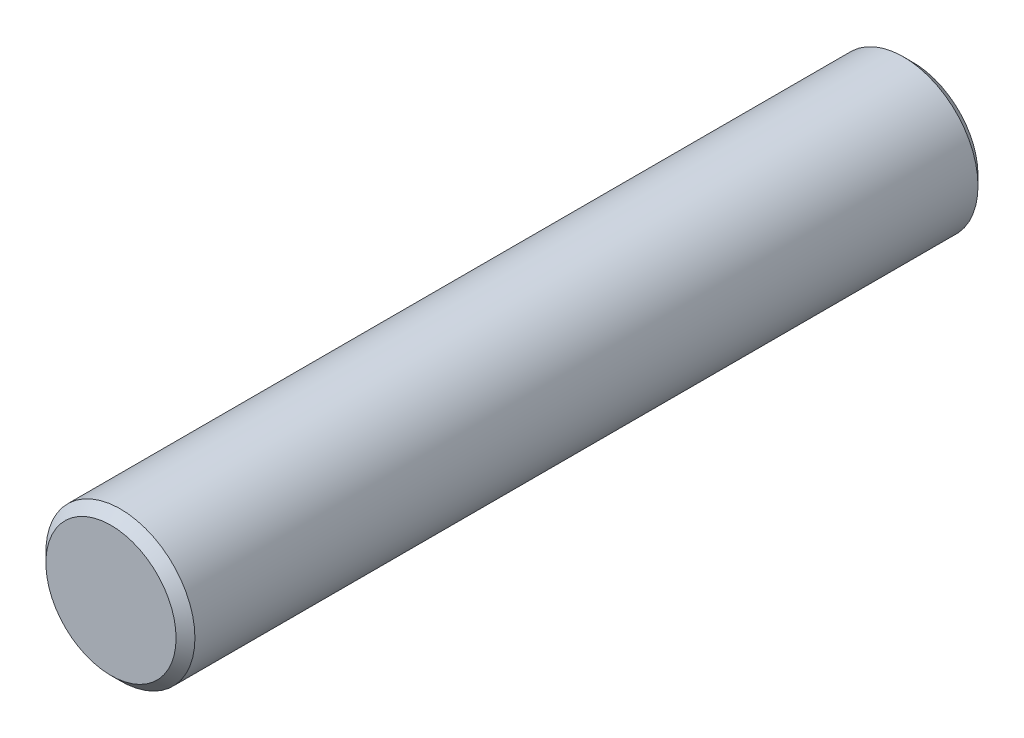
SolidWorks part; units mm, degrees
ref_plane "Plane1" through (0, 0, 0) normal (0, 0, 1) x (1, 0, 0)
ref_plane "Plane2" through (0, 0, 0) normal (0, 1, 0) x (1, 0, 0)
ref_plane "Plane3" through (0, 0, 0) normal (1, 0, 0) x (0, 0, -1)
sketch "Sketch1" plane through (0, 0, 0) normal (0, 0, 1) x (1, 0, 0)
  circle A0 centre (0, 0) radius 0.79
  dimension "D1" = 1.58
extrude "drive shaft pin shape" add sketch "Sketch1" along normal blind 8.5
chamfer "drive shaft pin chamfer" distance 0.1 angle 45 2 edges at (0.79, 0, 0) (0.79, 0, 8.5)
equation "\"result\"= 0.000133"
equation "\"result\"= 2*2"
equation "\"result\"= 1*2"
equation "\"result\"= 1.000000*1.560000"
